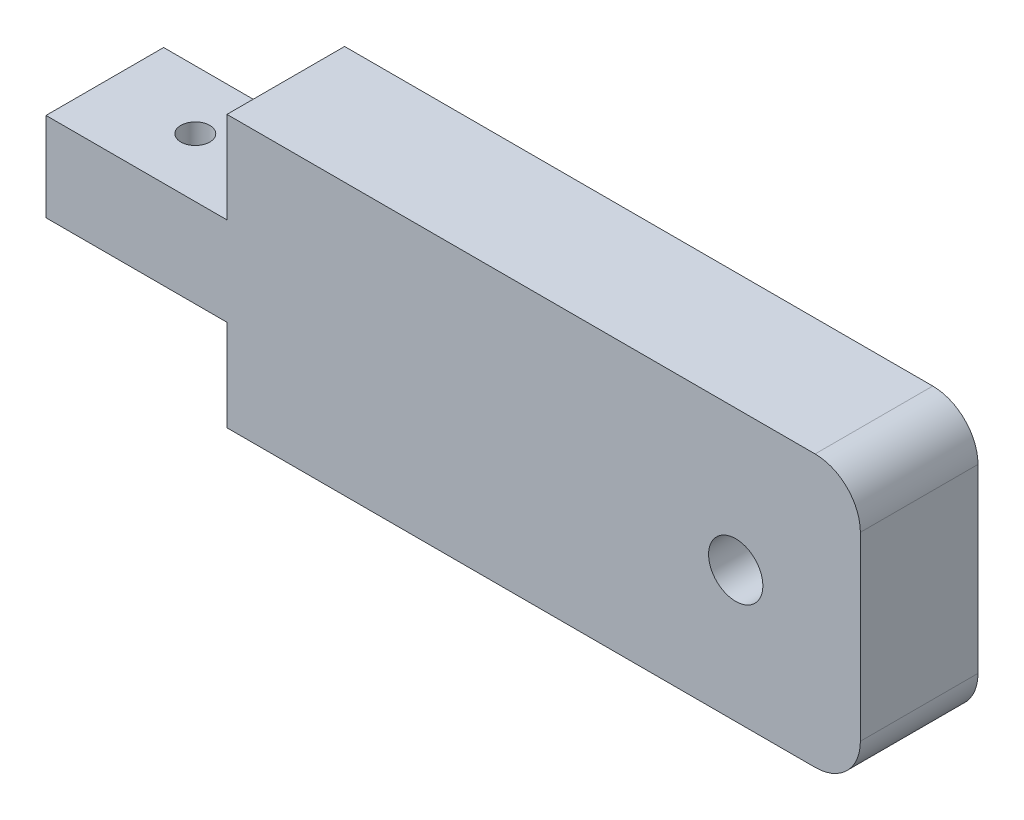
SolidWorks part; units mm, degrees
ref_plane "Front Plane" through (0, 0, 0) normal (0, 0, 1) x (1, 0, 0)
ref_plane "Top Plane" through (0, 0, 0) normal (0, 1, 0) x (1, 0, 0)
ref_plane "Right Plane" through (0, 0, 0) normal (1, 0, 0) x (0, 0, -1)
sketch "Sketch1" plane through (0, 0, 0) normal (0, 0, 1) x (1, 0, 0)
  line L1 (0, 0) -> (355.325, 0)
  line L2 (0, 0) -> (0, 30)
  line L3 (0, 30) -> (355.325, 30)
  line L4 (355.325, 0) -> (355.325, 30)
  line L5 (50, 0) -> (250, 0)
  line L6 (50, 0) -> (50, -17)
  line L7 (50, -17) -> (250, -17)
  line L8 (250, 0) -> (250, -17)
  line L9 (0, 0) -> (355.325, 0)
  line L10 (0, 0) -> (0, -17)
  line L11 (0, -17) -> (355.325, -17)
  line L12 (355.325, 0) -> (355.325, -17)
  line L13 (0, 0) -> (177.6625, 0)
  line L14 (0, 0) -> (0, -17)
  line L15 (0, -17) -> (177.6625, -17)
  line L16 (177.6625, 0) -> (177.6625, -17)
  line L17 (0, 0) -> (50, 0)
  line L18 (0, 0) -> (0, -5)
  line L19 (0, -5) -> (50, -5)
  line L20 (50, 0) -> (50, -5)
  circle A0 centre (20.775, 14.5) radius 12.5
  circle A1 centre (334.55, 14.5) radius 12.5
  circle A2 centre (60, -2.5) radius 1
  circle A3 centre (68, -2.5) radius 1
  circle A4 centre (60, -14.5) radius 1
  circle A5 centre (68, -14.5) radius 1
  dimension "D1" = 25
  dimension "D11" = 2
  dimension "D2" = 313.775
  dimension "D3" = 20.775
  dimension "D4" = 20.775
  dimension "D5" = 30
  dimension "D6" = 15.5
  dimension "D7" = 15.5
  dimension "D8" = 17
  dimension "D9" = 50
  dimension "D10" = 200
  dimension "D12" = 8
  dimension "D13" = 12
  dimension "D14" = 8
  dimension "D15" = 12
  dimension "D16" = 10
  dimension "D17" = 10
  dimension "D18" = 2.5
  dimension "D19" = 2.5
  dimension "D20" = 5
extrude "Boss-Extrude3" add sketch "Sketch1" along normal blind 13 contours L1 L9 L4 L3 L2 A1 A0 | L16 L1 L6 L7 A5 A4 A3 A2 | L10 L19 L6 L1
fillet "Fillet3" radius 5 6 edges at (355.325, 0, 6.5) (355.325, 30, 6.5) (177.6625, -17, 6.5) (50, -17, 6.5) (0, -5, 6.5) (0, 30, 6.5)
sketch "Sketch4" plane through (0, 0, 13) normal (0, 0, 1) x (1, 0, 0)
  line L0 (25.6361, 30) -> (25.6361, 0.3095)
  line L1 (5, 30) -> (350.325, 30) construction
  circle A0 centre (20.775, 14.5) radius 15
  circle A1 centre (20.775, 14.5) radius 12.5
  dimension "D1" = 30
extrude "Boss-Extrude5" add sketch "Sketch4" along normal blind 30 contours L0 A0 M16
fillet "Fillet4" radius 2 1 edges at (5.775, 14.5, 13)
sketch "Sketch5" plane through (0, 0, 0) normal (0, 0, -1) x (-1, 0, 0)
  circle A0 centre (-68, -2.5) radius 1.425
  circle A1 centre (-60, -2.5) radius 1.425
  circle A2 centre (-60, -14.5) radius 1.425
  circle A3 centre (-68, -14.5) radius 1.425
  dimension "D1" = 2.85
extrude "Cut-Extrude1" cut sketch "Sketch5" against normal up to next
sketch "Sketch6" plane through (0, 0, 13) normal (0, 0, 1) x (1, 0, 0)
  line L0 (113.8312, -17) -> (113.8312, 30)
  line L1 (55, -17) -> (172.6625, -17) construction
  line L2 (25.6361, 30) -> (350.325, 30) construction
  circle A0 centre (60, -2.5) radius 1.425
  circle A1 centre (68, -2.5) radius 1.425
  circle A2 centre (68, -14.5) radius 1.425
  circle A3 centre (60, -14.5) radius 1.425
  circle A4 centre (167.6625, -14.5) radius 1.425
  circle A5 centre (159.6625, -14.5) radius 1.425
  circle A6 centre (159.6625, -2.5) radius 1.425
  circle A7 centre (167.6625, -2.5) radius 1.425
extrude "Cut-Extrude2" cut sketch "Sketch6" against normal through all contours A6 | A7 | A4 | A5
sketch "Sketch7" plane through (0, 0, 13) normal (0, 0, 1) x (1, 0, 0)
  line L0 (55, -17) -> (172.6625, -17) construction
  line L1 (113.8312, -17) -> (50, -17)
  line L2 (113.8312, -17) -> (113.8312, -5)
  line L3 (113.8312, -5) -> (50, -5)
  line L4 (50, -17) -> (50, -5)
extrude "Cut-Extrude3" cut sketch "Sketch7" against normal through all
fillet "Fillet5" radius 5 1 edges at (113.8312, -17, 6.5)
sketch "Sketch8" plane through (0, 0, 13) normal (0, 0, 1) x (1, 0, 0)
  line L0 (5, -5) -> (113.8312, -5) construction
  line L1 (52.3855, -5) -> (74.1805, -5)
  line L2 (52.3855, -5) -> (52.3855, 2.0745)
  line L3 (52.3855, 2.0745) -> (74.1805, 2.0745)
  line L4 (74.1805, -5) -> (74.1805, 2.0745)
extrude "Boss-Extrude6" add sketch "Sketch8" against normal blind 10
sketch "Sketch9" plane through (0, 0, 13) normal (0, 0, 1) x (1, 0, 0)
  line L1 (113.8312, -5) -> (32.4684, -5)
  line L2 (113.8312, -5) -> (113.8312, 0)
  line L3 (113.8312, 0) -> (32.4684, 0)
  line L4 (32.4684, -5) -> (32.4684, 0)
extrude "Cut-Extrude4" cut sketch "Sketch9" against normal through all
sketch "Sketch10" plane through (0, 0, 0) normal (0, 0, -1) x (-1, 0, 0)
  line L1 (-177.6625, 0) -> (-113.8312, 0)
  line L2 (-177.6625, 0) -> (-177.6625, -17)
  line L3 (-177.6625, -17) -> (-113.8312, -17)
  line L4 (-113.8312, 0) -> (-113.8312, -17)
extrude "Cut-Extrude5" cut sketch "Sketch10" against normal blind 5
sketch "Sketch12" plane through (0, 0, 13) normal (0, 0, 1) x (1, 0, 0)
  circle A0 centre (159.6625, -2.5) radius 1
  circle A1 centre (167.6625, -2.5) radius 1
  circle A2 centre (167.6625, -14.5) radius 1
  circle A3 centre (159.6625, -14.5) radius 1
  circle A4 centre (159.6625, -14.5) radius 2.2725
  circle A5 centre (167.6625, -14.5) radius 2.3322
  circle A6 centre (167.6625, -2.5) radius 2.5118
  circle A7 centre (159.6625, -2.5) radius 2.5658
  dimension "D1" = 2
extrude "Boss-Extrude7" add sketch "Sketch12" against normal blind 8
sketch "Sketch13" plane through (0, 0, 43) normal (0, 0, 1) x (1, 0, 0)
  line L0 (25.6361, 30) -> (25.6361, -5)
  line L1 (5, -5) -> (32.4684, -5) construction
  circle A0 centre (20.775, 14.5) radius 15
  circle A1 centre (20.775, 14.5) radius 12.5
extrude "Boss-Extrude8" add sketch "Sketch13" along normal blind 30 contours M4 M1 M2 M3
sketch "Sketch14" plane through (0, 0, 13) normal (0, 0, 1) x (1, 0, 0)
  line L0 (0, 0) -> (0, 25) construction
  line L1 (25.6361, 30) -> (350.325, 30) construction
  circle A0 centre (85, 15) radius 13
  circle A1 centre (165, 15) radius 13
  circle A2 centre (245, 15) radius 13
  dimension "D1" = 26
  dimension "D2" = 26
  dimension "D3" = 26
  dimension "D6" = 245
  dimension "D4" = 85
  dimension "D5" = 165
  dimension "D7" = 15
  dimension "D8" = 15
  dimension "D9" = 15
extrude "Cut-Extrude7" cut sketch "Sketch14" against normal through all
sketch "Sketch15" plane through (0, 0, 13) normal (0, 0, 1) x (1, 0, 0)
  circle A0 centre (334.55, 14.5) radius 13.0784
extrude "Boss-Extrude9" add sketch "Sketch15" against normal blind 5.8
sketch "Sketch16" plane through (0, 0, 7.2) normal (0, 0, -1) x (-1, 0, 0)
  circle A0 centre (-334.55, 14.5) radius 2.5
  dimension "D1" = 5
extrude "Cut-Extrude8" cut sketch "Sketch16" against normal blind 27
sketch "Sketch17" plane through (0, 0, 0) normal (-1, 0, 0) x (0, 0, 1)
  line L1 (0, 30) -> (13, 30)
  line L2 (0, 30) -> (0, -5)
  line L3 (0, -5) -> (13, -5)
  line L4 (13, 30) -> (13, -5)
extrude "Cut-Extrude9" cut sketch "Sketch17" against normal blind 4
fillet "Fillet6" radius 5 1 edges at (4, 29.899, 6.5)
fillet "Fillet7" radius 5 1 edges at (4, -4.899, 6.5)
sketch "Sketch18" plane through (355.325, 0, 0) normal (1, 0, 0) x (0, 0, -1)
  line L1 (-13, 30) -> (0, 30)
  line L2 (-13, 30) -> (-13, 0)
  line L3 (-13, 0) -> (0, 0)
  line L4 (0, 30) -> (0, 0)
extrude "Cut-Extrude10" cut sketch "Sketch18" against normal blind 7
fillet "Fillet8" radius 5 2 edges at (348.325, 0, 6.5) (348.325, 30, 6.5)
sketch "Sketch20" plane through (0, 0, 13) normal (0, 0, 1) x (1, 0, 0)
  circle A0 centre (85, 15) radius 12.75
  circle A1 centre (85, 15) radius 13
  circle A2 centre (165, 15) radius 12.75
  circle A3 centre (165, 15) radius 13
  circle A4 centre (245, 15) radius 13
  circle A5 centre (245, 15) radius 12.75
  dimension "D1" = 25.5
  dimension "D2" = 25.5
  dimension "D3" = 25.5
extrude "Boss-Extrude10" add sketch "Sketch20" against normal up to surface (13 mm away)
sketch "Sketch22" plane through (0, 0, 73) normal (0, 0, 1) x (1, 0, 0)
  circle A0 centre (20.775, 14.5) radius 13.25
  dimension "D1" = 26.5
extrude "Cut-Extrude11" cut sketch "Sketch22" against normal through all
sketch "Sketch24" plane through (0, 0, 13) normal (0, 0, 1) x (1, 0, 0)
  circle A0 centre (334.55, 14.5) radius 2.75
  dimension "D1" = 5.5
extrude "Cut-Extrude12" cut sketch "Sketch24" against normal through all
sketch "Sketch26" plane through (0, 0, 13) normal (0, 0, 1) x (1, 0, 0)
  line L0 (113.8312, 0) -> (32.4684, 0) construction
  line L1 (50.005, 0) -> (113.835, 0)
  line L2 (50.005, 0) -> (50.005, -17)
  line L3 (50.005, -17) -> (113.835, -17)
  line L4 (113.835, 0) -> (113.835, -17)
  line L5 (9, -5) -> (32.4684, -5) construction
  line L6 (32.4684, 0) -> (50.005, 0)
  line L7 (32.4684, 0) -> (32.4684, -5)
  line L8 (32.4684, -5) -> (50.005, -5)
  line L9 (50.005, 0) -> (50.005, -5)
  arc A0 (25.6361, 2.1739) -> (25.6361, 26.8261) centre (20.775, 14.5) ccw construction
  circle A1 centre (60.005, -2.5) radius 1.25
  circle A2 centre (68.005, -2.5) radius 1.25
  circle A3 centre (68.005, -14.5) radius 1.25
  circle A4 centre (60.005, -14.5) radius 1.25
  dimension "D1" = 29.23
  dimension "D4" = 2.5
  dimension "D10" = 10
  dimension "D2" = 63.83
  dimension "D3" = 17
  dimension "D5" = 8
  dimension "D6" = 12
  dimension "D7" = 2.5
  dimension "D8" = 8
  dimension "D9" = 12
  dimension "D11" = 10
  dimension "D12" = 2.5
extrude "Boss-Extrude11" add sketch "Sketch26" against normal up to surface (13 mm away) contours L4 L2 L3 A4 A3 A2 A1 M13 M12 M11 | L8 L2 M10 M11
fillet "Fillet9" radius 5 2 edges at (50.005, -17, 6.5) (113.835, -17, 6.5)
sketch "Sketch27" plane through (0, 0, 0) normal (0, 0, -1) x (-1, 0, 0)
  circle A0 centre (-68.005, -2.5) radius 2
  circle A1 centre (-60.005, -2.5) radius 2
  circle A2 centre (-60.005, -14.5) radius 2
  circle A3 centre (-68.005, -14.5) radius 2
  dimension "D1" = 4
sketch "Sketch28" plane through (0, 0, 5) normal (0, 0, -1) x (-1, 0, 0)
  line L1 (-177.6625, 0) -> (-113.8312, 0)
  line L2 (-177.6625, 0) -> (-177.6625, -17.3361)
  line L3 (-177.6625, -17.3361) -> (-113.8312, -17.3361)
  line L4 (-113.8312, 0) -> (-113.8312, -17.3361)
extrude "Cut-Extrude14" cut sketch "Sketch28" against normal through all
extrude "Cut-Extrude17" cut sketch "Sketch27" against normal through all
sketch "Sketch30" plane through (0, 0, 0) normal (0, 0, -1) x (-1, 0, 0)
  circle A0 centre (-334.55, 14.5) radius 13.25
  dimension "D1" = 26.5
extrude "Cut-Extrude18" cut sketch "Sketch30" against normal up to surface (7.2 mm away)
sketch "Sketch31" plane through (0, 0, 7.2) normal (0, 0, -1) x (-1, 0, 0)
  circle A0 centre (-334.55, 14.5) radius 3
  dimension "D1" = 6
extrude "Cut-Extrude19" cut sketch "Sketch31" against normal through all
sketch "Sketch32" plane through (0, 0, 0) normal (0, 0, -1) x (-1, 0, 0)
  line L0 (-283.325, 30) -> (-283.325, 19.9)
  line L1 (-9, 30) -> (-343.325, 30) construction
  line L2 (-283.325, 19.9) -> (-263.325, 19.9)
  line L3 (-263.325, 19.9) -> (-263.325, 10.1)
  line L4 (-263.325, 10.1) -> (-283.325, 10.1)
  line L5 (-283.325, 10.1) -> (-283.325, 0)
  line L6 (-113.8312, 0) -> (-343.325, 0) construction
  line L7 (-348.325, 5) -> (-348.325, 25) construction
  line L16 (-108.8313, -17) -> (-55.005, -17)
  line L17 (-50.005, -12) -> (-50.005, -5)
  line L18 (-50.005, -5) -> (-9, -5)
  line L19 (-4, 0) -> (-4, 25)
  line L20 (-9, 30) -> (-343.325, 30)
  line L21 (-348.325, 25) -> (-348.325, 5)
  line L22 (-343.325, 0) -> (-113.8312, 0)
  line L23 (-113.8312, 0) -> (-113.8312, -12)
  line L24 (-108.8313, -17) -> (-55.005, -17)
  line L25 (-50.005, -12) -> (-50.005, -5)
  line L26 (-50.005, -5) -> (-9, -5)
  line L27 (-4, 0) -> (-4, 25)
  line L28 (-9, 30) -> (-343.325, 30)
  line L29 (-348.325, 25) -> (-348.325, 5)
  line L30 (-343.325, 0) -> (-113.8312, 0)
  line L31 (-113.8312, 0) -> (-113.8312, -12)
  arc A6 (-55.005, -17) -> (-50.005, -12) centre (-55.005, -12) ccw
  arc A7 (-9, -5) -> (-4, 0) centre (-9, 0) ccw
  arc A8 (-4, 25) -> (-9, 30) centre (-9, 25) ccw
  arc A9 (-343.325, 30) -> (-348.325, 25) centre (-343.325, 25) ccw
  arc A10 (-348.325, 5) -> (-343.325, 0) centre (-343.325, 5) ccw
  arc A11 (-113.8312, -12) -> (-108.8313, -17) centre (-108.8313, -12) ccw
  arc A12 (-55.005, -17) -> (-50.005, -12) centre (-55.005, -12) ccw
  arc A13 (-9, -5) -> (-4, 0) centre (-9, 0) ccw
  arc A14 (-4, 25) -> (-9, 30) centre (-9, 25) ccw
  arc A15 (-343.325, 30) -> (-348.325, 25) centre (-343.325, 25) ccw
  arc A16 (-348.325, 5) -> (-343.325, 0) centre (-343.325, 5) ccw
  arc A17 (-113.8312, -12) -> (-108.8313, -17) centre (-108.8313, -12) ccw
  dimension "D1" = 65
  dimension "D2" = 20
  dimension "D3" = 10.1
  dimension "D4" = 10.1
  dimension "D5" = 65
  dimension "D6" = 0
extrude "Cut-Extrude22" cut sketch "Sketch32" against normal through all contours L4 L5 L0 L2 L3 M20 M21 M22 M9 M10 M11 M12 M13 M14 M15 M16 M6 M8 M23 M25 M26 M24 M7 M5
sketch "Sketch34" plane through (263.325, 0, 0) normal (-1, 0, 0) x (0, 0, 1)
  line L1 (-39.7927, 67.4941) -> (63.4553, 67.4941)
  line L2 (-39.7927, 67.4941) -> (-39.7927, -40.3943)
  line L3 (-39.7927, -40.3943) -> (63.4553, -40.3943)
  line L4 (63.4553, 67.4941) -> (63.4553, -40.3943)
extrude "Cut-Extrude24" cut sketch "Sketch34" along normal through all
sketch "Sketch35" plane through (283.325, 0, 0) normal (-1, 0, 0) x (0, 0, 1)
  line L1 (0, 30) -> (13, 30)
  line L2 (0, 30) -> (0, 0)
  line L3 (0, 0) -> (13, 0)
  line L4 (13, 30) -> (13, 0)
extrude "Boss-Extrude12" add sketch "Sketch35" along normal blind 5
sketch "Sketch36" plane through (263.325, 0, 0) normal (-1, 0, 0) x (0, 0, 1)
  line L1 (0, 19.9) -> (13, 19.9)
  line L2 (0, 19.9) -> (0, 10.1)
  line L3 (0, 10.1) -> (13, 10.1)
  line L4 (13, 19.9) -> (13, 10.1)
extrude "Boss-Extrude13" add sketch "Sketch36" along normal blind 5
sketch "Sketch37" plane through (0, 19.9, 0) normal (0, 1, 0) x (1, 0, 0)
  line L0 (278.325, 0) -> (258.325, 0) construction
  line L1 (258.325, -13) -> (258.325, 0) construction
  circle A0 centre (268.325, -6.5) radius 1.6
  dimension "D1" = 3.2
  dimension "D2" = 6.5
  dimension "D3" = 10
extrude "Cut-Extrude25" cut sketch "Sketch37" against normal through all
